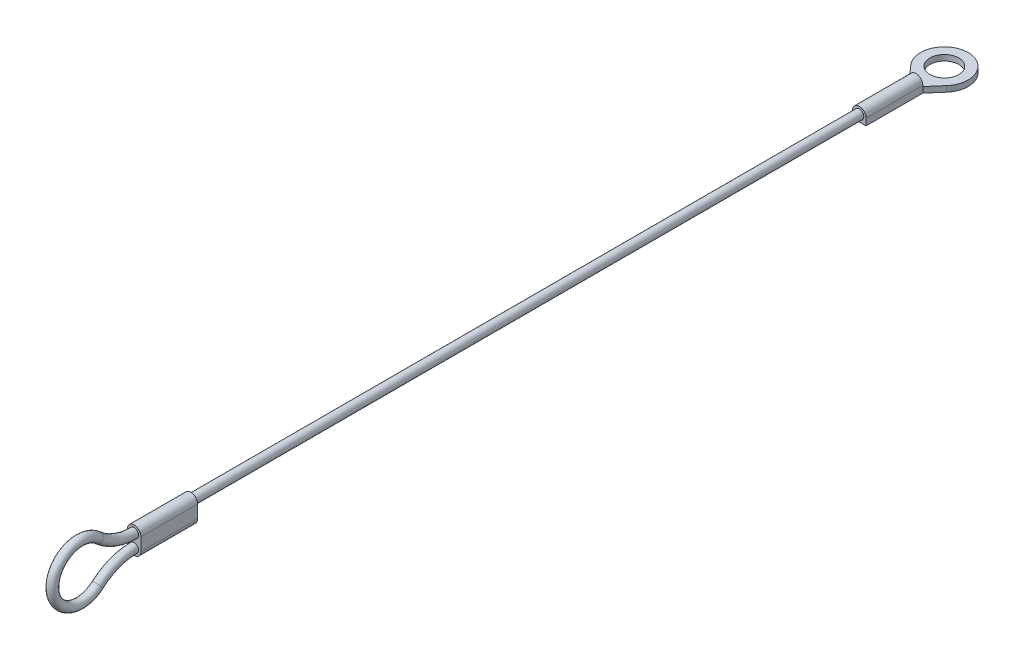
SolidWorks part; units mm, degrees
ref_plane "Front Plane" through (0, 0, 0) normal (0, 0, 1) x (1, 0, 0)
ref_plane "Top Plane" through (0, 0, 0) normal (0, 1, 0) x (1, 0, 0)
ref_plane "Right Plane" through (0, 0, 0) normal (1, 0, 0) x (0, 0, -1)
sketch "Sketch1" plane through (0, 0, 0) normal (1, 0, 0) x (0, 0, -1)
  line L2 (-127.8, 0) -> (0, 0)
  arc A0 (-127.8, 0) -> (-134.2, 2.4446) centre (-127.8, 9.6) cw
  arc A1 (-134.2, 2.4446) -> (-134.2, -4.7108) centre (-137.4, -1.1331) ccw
  arc A2 (-134.2, -4.7108) -> (-127.8, -2.2663) centre (-127.8, -11.8663) cw
  dimension "D1" = 4.8
  dimension "D4" = 9.6
  dimension "D2" = 137.4
  dimension "D3" = 9.6
sketch "Sketch2" plane through (0, 0, 0) normal (0, 0, 1) x (1, 0, 0)
  circle A0 centre (0, 0) radius 0.795
  dimension "D1" = 1.59
sweep "Sweep1" add profiles "Sketch2" path "Sketch1"
sketch "Sketch3" plane through (0, 0, 127.8) normal (0, 0, -1) x (-1, 0, 0)
  line L0 (0, 0) -> (0, -2.2663) construction
  line L1 (1.2, 0) -> (1.2, -2.2663)
  line L2 (-1.2, 0) -> (-1.2, -2.2663)
  line L3 (-0.795, -2.2663) -> (0.795, -2.2663) construction
  arc A0 (1.2, 0) -> (-1.2, 0) centre (0, 0) ccw
  arc A1 (-1.2, -2.2663) -> (1.2, -2.2663) centre (0, -2.2663) ccw
  point P3 (0, -1.1331)
  dimension "D1" = 2.4
extrude "Boss-Extrude1" add sketch "Sketch3" along normal blind 10
sketch "Sketch4" plane through (0, 0, 0) normal (0, 0, -1) x (-1, 0, 0)
  line L0 (-1.2, 0) -> (-1.2, -1.2)
  line L1 (-1.2, -1.2) -> (0, -1.2)
  line L2 (0, -1.2) -> (1.2, -1.2)
  line L3 (1.2, -1.2) -> (1.2, 0)
  arc A0 (1.2, 0) -> (-1.2, 0) centre (0, 0) ccw
  dimension "D1" = 2.4
extrude "Boss-Extrude2" add sketch "Sketch4" along normal blind 10
sketch "Sketch5" plane through (0, -1.2, 0) normal (0, -1, 0) x (1, 0, 0)
  line L0 (-1.2, -10) -> (1.2, -10)
  line L1 (1.2, -10) -> (3.1585, -12.2468)
  line L2 (-3.1585, -12.2468) -> (-1.2, -10)
  arc A0 (3.1585, -12.2468) -> (-3.1585, -12.2468) centre (0, -15) cw
  circle A1 centre (0, -15) radius 2.54
  point P8 (-4.19, -15)
  point P9 (4.19, -15)
  dimension "D1" = 5.08
  dimension "D2" = 8.38
  dimension "D3" = 15
extrude "Boss-Extrude3" add sketch "Sketch5" against normal blind 1.01
